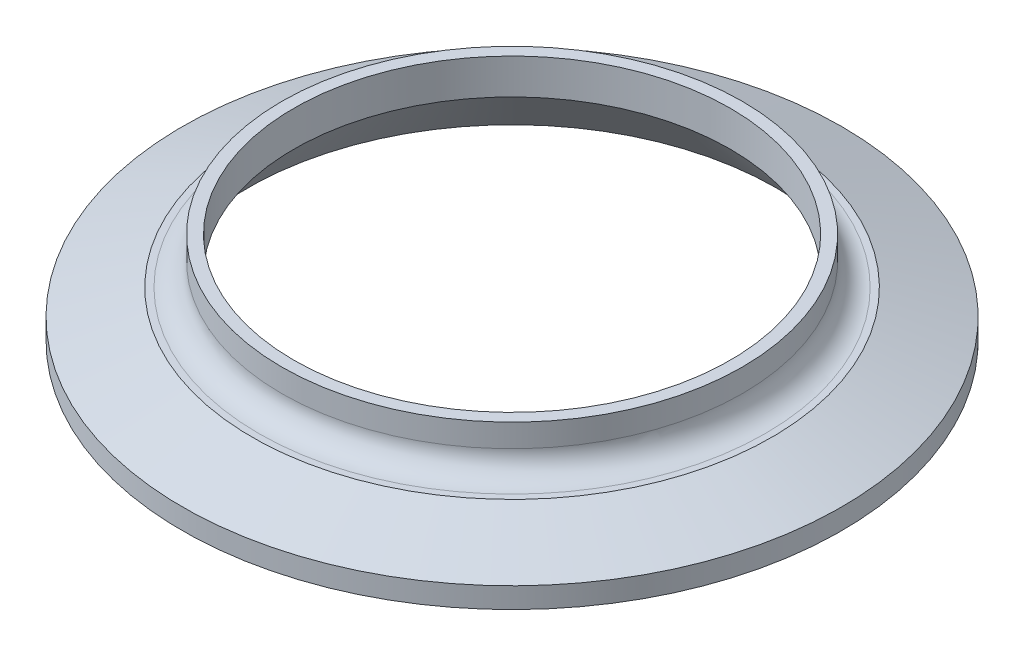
SolidWorks part; units mm, degrees
ref_plane "Front Plane" through (0, 0, 0) normal (0, 0, 1) x (1, 0, 0)
ref_plane "Top Plane" through (0, 0, 0) normal (0, 1, 0) x (1, 0, 0)
ref_plane "Right Plane" through (0, 0, 0) normal (1, 0, 0) x (0, 0, -1)
sketch "Sketch1" plane through (0, 0, 0) normal (0, 0, 1) x (1, 0, 0)
  line L0 (0, 0) -> (0, 8.8532) construction
  line L1 (-31.75, 12.7) -> (-31.75, 9.525)
  line L2 (-34.925, 6.35) -> (-35.8228, 6.35)
  line L3 (-35.8228, 6.35) -> (-45.4533, 2.8448)
  line L4 (-45.4533, 2.8448) -> (-45.4533, 0)
  line L5 (-45.4533, 0) -> (-43.6593, 0.0025)
  line L6 (-36.449, 0) -> (-39.6781, 0.0025)
  line L10 (-36.449, 0) -> (-30.099, 7.8137)
  line L11 (-30.099, 7.8137) -> (-30.099, 12.7)
  line L12 (-30.099, 12.7) -> (-31.75, 12.7)
  line L15 (-42.7676, 0.8754) -> (-42.9345, 0.4823)
  line L17 (-40.5698, 0.8754) -> (-40.4029, 0.4823)
  arc A0 (-34.925, 6.35) -> (-31.75, 9.525) centre (-34.925, 9.525) ccw
  arc A1 (-42.9345, 0.4823) -> (-43.6593, 0.0025) centre (-43.6593, 0.7899) cw
  arc A2 (-39.6781, 0.0025) -> (-40.4029, 0.4823) centre (-39.6781, 0.7899) cw
  arc A3 (-40.5698, 0.8754) -> (-42.7676, 0.8754) centre (-41.6687, 0.4089) ccw
  dimension "D3" = 3.175
  dimension "D7" = 0.7874
  dimension "D8" = 41.6687
  dimension "D9" = 0.7874
  dimension "D2" = 30.099
  dimension "D4" = 12.7
  dimension "D5" = 6.35
  dimension "D6" = 45.4533
  dimension "D10" = 20
  dimension "D11" = 36.449
  dimension "D12" = 31.75
  dimension "D13" = 2.8448
  dimension "D14" = 39.1
revolve "Revolve1" add sketch "Sketch1" angle 360 about L0
